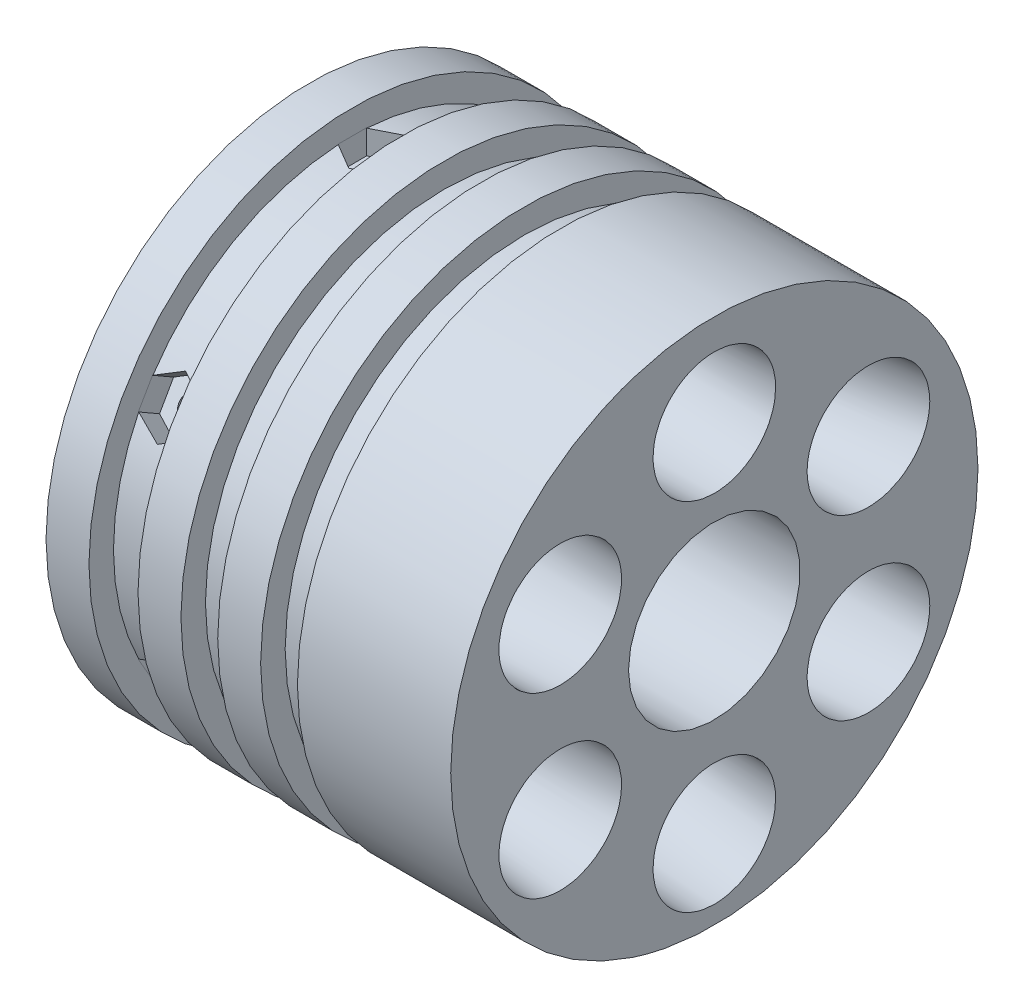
SolidWorks part; units mm, degrees
ref_plane "Front Plane" through (0, 0, 0) normal (0, 0, 1) x (1, 0, 0)
ref_plane "Top Plane" through (0, 0, 0) normal (0, 1, 0) x (1, 0, 0)
ref_plane "Right Plane" through (0, 0, 0) normal (1, 0, 0) x (0, 0, -1)
sketch "Sketch1" plane through (0, 0, 0) normal (0, 0, 1) x (1, 0, 0)
  line L0 (-1012.2271, 0) -> (49599.1281, 0) construction
  line L1 (0, 0) -> (0, 273.05)
  line L2 (0, 273.05) -> (44.45, 273.05)
  line L3 (44.45, 273.05) -> (44.45, 247.65)
  line L4 (44.45, 247.65) -> (95.25, 247.65)
  line L5 (95.25, 247.65) -> (95.25, 273.05)
  line L6 (95.25, 273.05) -> (139.7, 273.05)
  line L7 (139.7, 273.05) -> (139.7, 247.65)
  line L8 (139.7, 247.65) -> (177.8, 247.65)
  line L9 (177.8, 247.65) -> (177.8, 273.05)
  line L10 (177.8, 273.05) -> (222.25, 273.05)
  line L11 (419.1, 273.05) -> (419.1, 0)
  line L12 (222.25, 273.05) -> (222.25, 247.65)
  line L13 (222.25, 247.65) -> (260.35, 247.65)
  line L14 (260.35, 247.65) -> (260.35, 273.05)
  line L15 (260.35, 273.05) -> (419.1, 273.05)
  line L16 (0, 0) -> (419.1, 0)
  dimension "D1" = 273.05
  dimension "D2" = 44.45
  dimension "D3" = 419.1
  dimension "D4" = 50.8
  dimension "D5" = 25.4
  dimension "D6" = 38.1
revolve "Revolve1" add sketch "Sketch1" angle 360 about L0
sketch "Sketch2" plane through (0, 0, 0) normal (-1, 0, 0) x (0, 0, 1)
  line L0 (0, -1000) -> (0, 49000) construction
  line L1 (0, 0) -> (0, 247.65) construction
  line L2 (-1000, 247.65) -> (49000, 247.65) construction
  line L3 (-1000, 0) -> (49000, 0) construction
  line L4 (-76.2, -841.25) -> (-76.2, 49158.75) construction
  line L5 (76.2, -841.25) -> (76.2, 49158.75) construction
  ellipse E0 centre (0, 158.75) end of major axis (76.2, 158.75) minor radius 38.1
  point P48 (0, 0)
  dimension "D1" = 76.2
  dimension "D2" = 88.9
  dimension "D4" = 158.75
  dimension "D3" = 247.65
  dimension "D5" = 158.75
  dimension "D6" = 152.4
sketch "Sketch3" plane through (419.1, 0, 0) normal (1, 0, 0) x (0, 0, -1)
  line L0 (-1000, 0) -> (49000, 0) construction
  line L2 (-1154.9839, 165.1) -> (48845.0161, 165.1) construction
  line L3 (0, -1012.7) -> (0, 48987.3) construction
  circle A3 centre (0, 177.8) radius 63.5
  circle A4 centre (0, 0) radius 273.05 construction
  dimension "D1" = 127
  dimension "D3" = 177.8
  dimension "D2" = 165.1
loft "Cut-Loft2" cut profiles "Sketch2", "Sketch3"
pattern_circular "CirPattern2" count 6 over 360 about axis through (0, 0, 0) along (1, 0, 0) of "Cut-Loft2"
sketch "Sketch4" plane through (0, 0, 0) normal (-1, 0, 0) x (0, 0, 1)
  circle A0 centre (0, 0) radius 88.9
  dimension "D1" = 177.8
extrude "Cut-Extrude1" cut sketch "Sketch4" against normal blind 508
ref_plane "Plane1" through (0, 247.65, 0) normal (0, 1, 0) x (1, 0, 0)
sketch "Sketch5" plane through (0, 247.65, 0) normal (0, 1, 0) x (1, 0, 0)
  line L0 (44.45, 0) -> (95.25, 0) construction
  line L1 (44.45, -247.65) -> (44.45, 247.65) construction
  line L2 (95.25, 273.05) -> (95.25, -273.05) construction
  line L3 (69.85, -1000) -> (69.85, 49000) construction
  line L5 (95.25, 14.8286) -> (69.7081, 29.4113)
  line L6 (69.7081, 29.4113) -> (44.3081, 14.5828)
  line L7 (44.3081, 14.5828) -> (44.45, -14.8286)
  line L8 (44.45, -14.8286) -> (69.9919, -29.4113)
  line L9 (69.9919, -29.4113) -> (95.3919, -14.5828)
  line L10 (95.3919, -14.5828) -> (95.25, 14.8286)
  circle A0 centre (69.85, 0) radius 25.4713 construction
  point P10 (69.85, 0)
extrude "Cut-Extrude2" cut sketch "Sketch5" against normal blind 25.4
sketch "Sketch6" plane through (0, 0, 0) normal (0, 1, 0) x (1, 0, 0)
  line L0 (-1000, 0) -> (49000, 0) construction
sketch "Sketch7" plane through (0, 222.25, 0) normal (0, 1, 0) x (1, 0, 0)
  line L0 (44.379, -0.1229) -> (95.25, 0) construction
  line L1 (44.3081, 14.5828) -> (44.45, -14.8286) construction
  line L2 (-201000, 0) -> (249000, 0) construction
  line L3 (95.25, 273.05) -> (95.25, -273.05) construction
  line L4 (69.7081, 29.4113) -> (69.9919, -29.4113) construction
  circle A0 centre (69.8145, -0.0614) radius 12.7
  dimension "D1" = 25.4
extrude "Cut-Extrude3" cut sketch "Sketch7" against normal blind 50.8
pattern_circular "CirPattern4" count 6 over 360 about axis through (0, 0, 0) along (1, 0, 0) of "Cut-Extrude3", "Cut-Extrude2"
